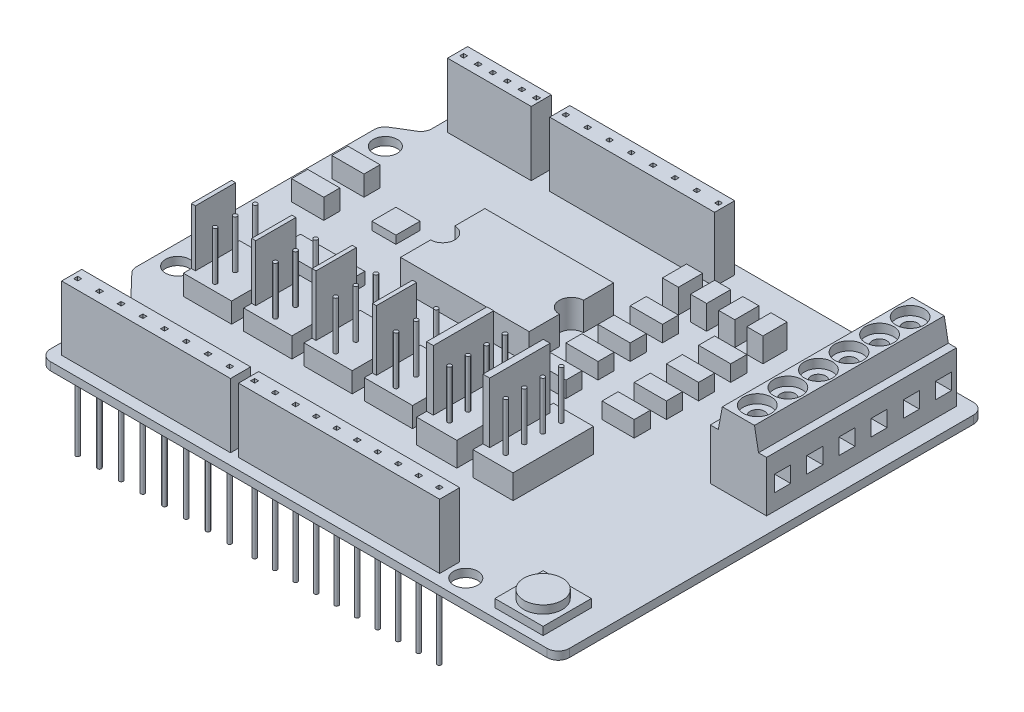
SolidWorks part; units mm, degrees
ref_plane "Alzado" through (0, 0, 0) normal (0, 0, 1) x (1, 0, 0)
ref_plane "Planta" through (0, 0, 0) normal (0, 1, 0) x (1, 0, 0)
ref_plane "Vista lateral" through (0, 0, 0) normal (1, 0, 0) x (0, 0, -1)
imported_body "Sólido importado1"
sketch "Croquis1" plane through (0, 1, 0) normal (0, 1, 0) x (1, 0, 0)
  line L0 (6.3951, 20.5514) -> (8.3951, 20.5514)
  line L1 (2.8951, 20.5514) -> (4.8951, 20.5514)
  line L2 (2.8951, 20.5514) -> (2.8951, 17.5514)
  line L3 (2.8951, 17.5514) -> (4.8951, 17.5514)
  line L4 (4.8951, 20.5514) -> (4.8951, 17.5514)
  line L5 (6.3951, 20.5514) -> (6.3951, 17.5514)
  line L6 (6.3951, 17.5514) -> (8.3951, 17.5514)
  line L7 (8.3951, 20.5514) -> (8.3951, 17.5514)
  line L8 (9.8951, 20.5514) -> (11.8951, 20.5514)
  line L9 (9.8951, 20.5514) -> (9.8951, 17.5514)
  line L10 (9.8951, 17.5514) -> (11.8951, 17.5514)
  line L11 (11.8951, 20.5514) -> (11.8951, 17.5514)
  line L12 (13.3951, 20.5514) -> (15.3951, 20.5514)
  line L13 (13.3951, 20.5514) -> (13.3951, 17.5514)
  line L14 (13.3951, 17.5514) -> (15.3951, 17.5514)
  line L15 (15.3951, 20.5514) -> (15.3951, 17.5514)
  dimension "D1" = 3
  dimension "D2" = 2
  dimension "D3" = 4
extrude "Saliente-Extruir1" add sketch "Croquis1" along normal blind 3
sketch "Croquis2" plane through (0, 1, 0) normal (0, 1, 0) x (1, 0, 0)
  line L0 (2.8951, 17.5514) -> (4.8951, 17.5514) construction
  line L1 (2.8951, 15.5514) -> (6.8951, 15.5514)
  line L2 (2.8951, 15.5514) -> (2.8951, 13.5514)
  line L3 (2.8951, 13.5514) -> (6.8951, 13.5514)
  line L4 (6.8951, 15.5514) -> (6.8951, 13.5514)
  line L5 (11.3951, 13.5514) -> (15.3951, 13.5514)
  line L6 (11.3951, 15.5514) -> (11.3951, 13.5514)
  line L7 (11.3951, 15.5514) -> (15.3951, 15.5514)
  line L8 (15.3951, 15.5514) -> (15.3951, 13.5514)
  line L9 (11.3951, 9.5514) -> (15.3951, 9.5514)
  line L10 (11.3951, 11.5514) -> (11.3951, 9.5514)
  line L11 (11.3951, 11.5514) -> (15.3951, 11.5514)
  line L12 (15.3951, 11.5514) -> (15.3951, 9.5514)
  line L13 (11.3951, 5.5514) -> (15.3951, 5.5514)
  line L14 (11.3951, 7.5514) -> (11.3951, 5.5514)
  line L15 (11.3951, 7.5514) -> (15.3951, 7.5514)
  line L16 (15.3951, 7.5514) -> (15.3951, 5.5514)
  line L17 (11.3951, 1.5514) -> (15.3951, 1.5514)
  line L18 (11.3951, 3.5514) -> (11.3951, 1.5514)
  line L19 (11.3951, 3.5514) -> (15.3951, 3.5514)
  line L20 (15.3951, 3.5514) -> (15.3951, 1.5514)
  line L21 (2.8951, 9.5514) -> (6.8951, 9.5514)
  line L22 (2.8951, 11.5514) -> (2.8951, 9.5514)
  line L23 (2.8951, 11.5514) -> (6.8951, 11.5514)
  line L24 (6.8951, 11.5514) -> (6.8951, 9.5514)
  line L25 (2.8951, 5.5514) -> (6.8951, 5.5514)
  line L26 (2.8951, 7.5514) -> (2.8951, 5.5514)
  line L27 (2.8951, 7.5514) -> (6.8951, 7.5514)
  line L28 (6.8951, 7.5514) -> (6.8951, 5.5514)
  line L29 (2.8951, 1.5514) -> (6.8951, 1.5514)
  line L30 (2.8951, 3.5514) -> (2.8951, 1.5514)
  line L31 (2.8951, 3.5514) -> (6.8951, 3.5514)
  line L32 (6.8951, 3.5514) -> (6.8951, 1.5514)
  point P4 (3.8951, 17.5514)
  dimension "D1" = 2
  dimension "D2" = 2
  dimension "D3" = 4
  dimension "D4" = 2
  dimension "D5" = 4
extrude "Saliente-Extruir2" add sketch "Croquis2" along normal blind 2
sketch "Croquis3" plane through (0, 1, 0) normal (0, 1, 0) x (1, 0, 0)
  line L0 (2.8951, 11.5514) -> (2.8951, 9.5514) construction
  line L1 (0.8951, 13.4895) -> (-15.1049, 13.4895)
  line L2 (0.8951, 13.4895) -> (0.8951, 9.7395)
  line L3 (0.8951, 2.9895) -> (-15.1049, 2.9895)
  line L4 (-15.1049, 13.4895) -> (-15.1049, 9.7395)
  line L5 (-7.1049, 13.4895) -> (-7.1049, -3.7143) construction
  line L6 (-15.1049, 6.7395) -> (-15.1049, 2.9895)
  line L7 (0.8951, 6.7395) -> (0.8951, 2.9895)
  arc A0 (-15.1049, 6.7395) -> (-15.1049, 9.7395) centre (-15.1049, 8.2395) ccw
  arc A1 (0.8951, 6.7395) -> (0.8951, 9.7395) centre (0.8951, 8.2395) cw
  point P4 (2.8951, 10.5514)
  dimension "D4" = 3
  dimension "D1" = 16
  dimension "D2" = 10.5
  dimension "D3" = 2
extrude "Saliente-Extruir3" add sketch "Croquis3" along normal blind 3.5
sketch "Croquis4" plane through (0, 1, 0) normal (0, 1, 0) x (1, 0, 0)
  line L0 (7.6027, -2.7178) -> (7.6027, -12.7178)
  line L1 (14.6027, -2.7178) -> (9.6027, -2.7178)
  line L2 (14.6027, -2.7178) -> (14.6027, -12.7178)
  line L3 (14.6027, -12.7178) -> (9.6027, -12.7178)
  line L4 (9.6027, -2.7178) -> (9.6027, -12.7178)
  line L5 (7.6027, -2.7178) -> (2.6027, -2.7178)
  line L6 (2.6027, -2.7178) -> (2.6027, -12.7178)
  line L7 (7.6027, -12.7178) -> (2.6027, -12.7178)
  dimension "D1" = 5
  dimension "D2" = 10
  dimension "D3" = 2
extrude "Saliente-Extruir4" add sketch "Croquis4" along normal blind 3
sketch "Croquis5" plane through (0, 4, 0) normal (0, 1, 0) x (1, 0, 0)
  line L0 (2.6027, -2.7178) -> (2.6027, -12.7178) construction
  line L1 (2.6027, -3.9678) -> (3.4425, -3.9678)
  line L2 (2.6027, -3.9678) -> (2.6027, -11.4678)
  line L3 (2.6027, -11.4678) -> (3.4425, -11.4678)
  line L4 (3.4425, -3.9678) -> (3.4425, -11.4678)
  line L6 (2.6027, -12.7178) -> (7.6027, -12.7178) construction
  line L7 (9.6027, -3.9678) -> (9.6027, -11.4678)
  line L8 (9.6027, -3.9678) -> (10.4425, -3.9678)
  line L9 (10.4425, -3.9678) -> (10.4425, -11.4678)
  line L10 (9.6027, -11.4678) -> (10.4425, -11.4678)
  dimension "D1" = 7.5
  dimension "D2" = 1.25
  dimension "D3" = 2
extrude "Saliente-Extruir5" add sketch "Croquis5" along normal blind 7.5
sketch "Croquis6" plane through (0, 4, 0) normal (0, 1, 0) x (1, 0, 0)
  line L0 (7.6027, -2.7178) -> (2.6027, -2.7178) construction
  circle A0 centre (5.1027, -4.2178) radius 0.25
  circle A1 centre (12.1027, -4.2178) radius 0.25
  circle A2 centre (12.1027, -6.5178) radius 0.25
  circle A3 centre (12.1027, -8.8178) radius 0.25
  circle A4 centre (12.1027, -11.1178) radius 0.25
  circle A5 centre (5.1027, -6.5178) radius 0.25
  circle A6 centre (5.1027, -8.8178) radius 0.25
  circle A7 centre (5.1027, -11.1178) radius 0.25
  dimension "D1" = 0.5
  dimension "D2" = 1.5
  dimension "D3" = 2
  dimension "D4" = 4
extrude "Saliente-Extruir6" add sketch "Croquis6" along normal blind 6
sketch "Croquis7" plane through (0, 1, 0) normal (0, 1, 0) x (1, 0, 0)
  line L1 (0.6027, -4.2178) -> (-5.3973, -4.2178)
  line L2 (0.6027, -4.2178) -> (0.6027, -11.2178)
  line L3 (0.6027, -11.2178) -> (-5.3973, -11.2178)
  line L4 (-5.3973, -4.2178) -> (-5.3973, -11.2178)
  line L5 (7.6027, -2.7178) -> (2.6027, -2.7178) construction
  line L6 (2.6027, -3.9678) -> (2.6027, -11.4678) construction
  line L7 (-12.8973, -4.2178) -> (-12.8973, -11.2178)
  line L8 (-6.8973, -11.2178) -> (-12.8973, -11.2178)
  line L9 (-6.8973, -4.2178) -> (-6.8973, -11.2178)
  line L10 (-6.8973, -4.2178) -> (-12.8973, -4.2178)
  line L19 (-14.3973, -4.2178) -> (-20.3973, -4.2178)
  line L20 (-14.3973, -11.2178) -> (-20.3973, -11.2178)
  line L21 (-21.8973, -11.2178) -> (-27.8973, -11.2178)
  line L22 (-21.8973, -4.2178) -> (-21.8973, -11.2178)
  line L23 (-20.3973, -4.2178) -> (-20.3973, -11.2178)
  line L24 (-14.3973, -4.2178) -> (-14.3973, -11.2178)
  line L25 (-21.8973, -4.2178) -> (-27.8973, -4.2178)
  line L26 (-27.8973, -4.2178) -> (-27.8973, -11.2178)
  point P6 (5.1027, -2.7178)
  dimension "D1" = 7
  dimension "D2" = 1.5
  dimension "D3" = 6
  dimension "D4" = 2
  dimension "D5" = 4
extrude "Saliente-Extruir7" add sketch "Croquis7" along normal blind 2.5
sketch "Croquis8" plane through (0, 3.5, 0) normal (0, 1, 0) x (1, 0, 0)
  line L0 (-12.8973, -4.2178) -> (-12.8973, -11.2178) construction
  line L1 (-12.8973, -5.2178) -> (-12.3956, -5.2178)
  line L2 (-12.8973, -5.2178) -> (-12.8973, -10.2178)
  line L3 (-12.8973, -10.2178) -> (-12.3956, -10.2178)
  line L4 (-12.3956, -5.2178) -> (-12.3956, -10.2178)
  line L5 (-6.8973, -4.2178) -> (-12.8973, -4.2178) construction
  line L6 (-5.3973, -5.2178) -> (-5.3973, -10.2178)
  line L7 (-5.3973, -5.2178) -> (-4.8956, -5.2178)
  line L8 (-4.8956, -5.2178) -> (-4.8956, -10.2178)
  line L9 (-5.3973, -10.2178) -> (-4.8956, -10.2178)
  dimension "D1" = 5
  dimension "D2" = 1
  dimension "D3" = 2
extrude "Saliente-Extruir8" add sketch "Croquis8" along normal blind 7.5
sketch "Croquis9" plane through (0, 3.5, 0) normal (0, 1, 0) x (1, 0, 0)
  line L0 (-6.8973, -4.2178) -> (-12.8973, -4.2178) construction
  circle A0 centre (-9.8973, -5.2678) radius 0.25
  circle A1 centre (-2.3973, -5.2678) radius 0.25
  circle A2 centre (-2.3973, -7.7678) radius 0.25
  circle A3 centre (-2.3973, -10.2678) radius 0.25
  circle A4 centre (-9.8973, -7.7678) radius 0.25
  circle A5 centre (-9.8973, -10.2678) radius 0.25
  dimension "D1" = 0.5
  dimension "D2" = 1.05
  dimension "D3" = 2
  dimension "D4" = 3
extrude "Saliente-Extruir9" add sketch "Croquis9" along normal blind 6
sketch "Croquis10" plane through (0, 1, 0) normal (0, 1, 0) x (1, 0, 0)
  line L8 (-20.3973, -4.2178) -> (-20.3973, -11.2178)
  line L9 (-14.3973, -4.2178) -> (-20.3973, -4.2178)
  line L10 (-20.3973, -11.2178) -> (-14.3973, -11.2178)
  line L11 (-14.3973, -11.2178) -> (-14.3973, -4.2178)
  line L12 (-27.8973, -4.2178) -> (-27.8973, -11.2178)
  line L13 (-21.8973, -4.2178) -> (-27.8973, -4.2178)
  line L14 (-27.8973, -11.2178) -> (-21.8973, -11.2178)
  line L15 (-21.8973, -11.2178) -> (-21.8973, -4.2178)
extrude "Saliente-Extruir10" add sketch "Croquis10" along normal blind 2.5
sketch "Croquis11" plane through (0, 3.5, 0) normal (0, 1, 0) x (1, 0, 0)
  line L8 (-20.3973, -5.2178) -> (-20.3973, -10.2178)
  line L9 (-19.8956, -5.2178) -> (-20.3973, -5.2178)
  line L10 (-19.8956, -10.2178) -> (-19.8956, -5.2178)
  line L11 (-20.3973, -10.2178) -> (-19.8956, -10.2178)
  line L12 (-27.8973, -5.2178) -> (-27.8973, -10.2178)
  line L13 (-27.3956, -5.2178) -> (-27.8973, -5.2178)
  line L14 (-27.3956, -10.2178) -> (-27.3956, -5.2178)
  line L15 (-27.8973, -10.2178) -> (-27.3956, -10.2178)
extrude "Saliente-Extruir11" add sketch "Croquis11" along normal blind 7
sketch "Croquis12" plane through (0, 3.5, 0) normal (0, 1, 0) x (1, 0, 0)
  circle A6 centre (-17.3973, -5.2678) radius 0.25
  circle A7 centre (-17.3973, -10.2678) radius 0.25
  circle A8 centre (-17.3973, -7.7678) radius 0.25
  circle A9 centre (-24.8973, -5.2678) radius 0.25
  circle A10 centre (-24.8973, -10.2678) radius 0.25
  circle A11 centre (-24.8973, -7.7678) radius 0.25
extrude "Saliente-Extruir12" add sketch "Croquis12" along normal blind 6
sketch "Croquis13" plane through (0, 1, 0) normal (0, 1, 0) x (1, 0, 0)
  line L1 (-25.8186, 1.2683) -> (-17.8186, 1.2683)
  line L2 (-25.8186, 1.2683) -> (-25.8186, -1.7317)
  line L3 (-25.8186, -1.7317) -> (-17.8186, -1.7317)
  line L4 (-17.8186, 1.2683) -> (-17.8186, -1.7317)
  dimension "D1" = 8
  dimension "D2" = 3
extrude "Saliente-Extruir13" add sketch "Croquis13" along normal blind 1.5
sketch "Croquis14" plane through (0, 1, 0) normal (0, 1, 0) x (1, 0, 0)
  line L0 (2.8951, 13.5514) -> (6.8951, 13.5514) construction
  line L1 (-31.3447, 12.6898) -> (-27.3447, 12.6898)
  line L2 (-31.3447, 12.6898) -> (-31.3447, 10.6898)
  line L3 (-31.3447, 10.6898) -> (-27.3447, 10.6898)
  line L4 (-27.3447, 12.6898) -> (-27.3447, 10.6898)
  line L7 (-31.3447, 7.6898) -> (-31.3447, 5.6898)
  line L8 (-31.3447, 7.6898) -> (-27.3447, 7.6898)
  line L9 (-27.3447, 7.6898) -> (-27.3447, 5.6898)
  line L10 (-31.3447, 5.6898) -> (-27.3447, 5.6898)
  point P4 (4.8951, 13.5514)
  dimension "D1" = 2
  dimension "D2" = 4
  dimension "D3" = 2
extrude "Saliente-Extruir14" add sketch "Croquis14" along normal blind 2.5
sketch "Croquis15" plane through (0, 1, 0) normal (0, 1, 0) x (1, 0, 0)
  line L1 (-23.2821, 10.5992) -> (-20.2821, 10.5992)
  line L2 (-23.2821, 10.5992) -> (-23.2821, 7.5992)
  line L3 (-23.2821, 7.5992) -> (-20.2821, 7.5992)
  line L4 (-20.2821, 10.5992) -> (-20.2821, 7.5992)
  dimension "D1" = 3
  dimension "D2" = 3
extrude "Saliente-Extruir15" add sketch "Croquis15" along normal blind 1
